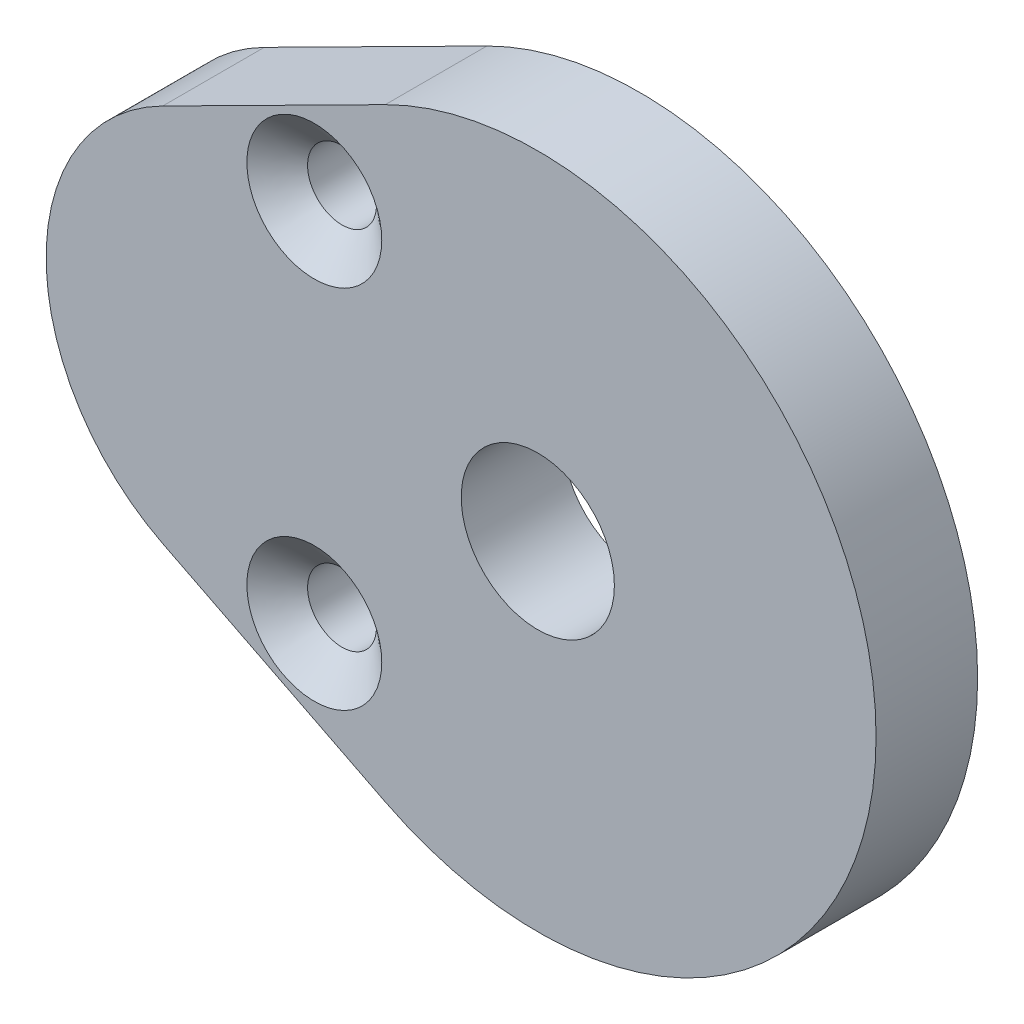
SolidWorks part; units mm, degrees
ref_plane "Front Plane" through (0, 0, 0) normal (0, 0, 1) x (1, 0, 0)
ref_plane "Top Plane" through (0, 0, 0) normal (0, 1, 0) x (1, 0, 0)
ref_plane "Right Plane" through (0, 0, 0) normal (1, 0, 0) x (0, 0, -1)
sketch "Sketch2" plane through (0, 0, 0) normal (0, 0, 1) x (1, 0, 0)
  line L0 (-20.5835, 6.1779) -> (-6.6714, 13.206) construction
  line L1 (-20.5835, -6.1779) -> (-6.6714, -13.206) construction
  line L2 (-23.4467, -11.8457) -> (-9.5347, -18.8738)
  line L3 (-23.4467, 11.8457) -> (-9.5347, 18.8738)
  arc A0 (-6.6714, -13.206) -> (-6.6714, 13.206) centre (0, 0) ccw construction
  arc A1 (-20.5835, 6.1779) -> (-20.5835, -6.1779) centre (-17.4625, 0) ccw construction
  arc A2 (-23.4467, 11.8457) -> (-23.4467, -11.8457) centre (-17.4625, 0) ccw
  arc A3 (-9.5347, -18.8738) -> (-9.5347, 18.8738) centre (0, 0) ccw
extrude "Boss-Extrude1" add sketch "Sketch2" along normal blind 6.35
sketch "Sketch3" plane through (0, 0, 6.35) normal (0, 0, 1) x (1, 0, 0)
  circle A0 centre (0, 0) radius 4.7879
extrude "Cut-Extrude1" cut sketch "Sketch3" against normal through all
sketch "Sketch6" plane through (0, 0, 6.35) normal (0, 0, 1) x (1, 0, 0)
  point P0 (-13.97, 11.43)
  point P2 (-13.97, -11.43)
  dimension "D1" = 11.43
  dimension "D2" = 13.97
  dimension "D3" = 11.43
  dimension "D4" = 13.97
hole_wizard "CSK for #8 Flat Head Machine Screw (100)1" positions "Sketch6" profile "Sketch5" countersink size "#8" standard "ANSI Inch"
sketch "Sketch5" plane through (-13.97, 11.43, 6.35) normal (1, 0, 0) x (0, -1, 0)
  line L0 (0, 0) -> (0, 6.35)
  line L1 (0, 6.35) -> (2.1526, 6.35)
  line L2 (2.1526, 6.35) -> (2.1526, 1.7317)
  line L3 (2.1526, 1.7317) -> (4.2164, 0)
  line L5 (4.2164, 0) -> (0, 0)
  line L6 (-2.1526, 1.7317) -> (-4.2164, 0) construction
  line L11 (0, -6.35) -> (0, 107.95) construction
  dimension "Thru Hole Dia." = 4.3053
  dimension "Thru Hole Depth" = 6.35
  dimension "Near C'Sink Dia." = 8.4328
  dimension "Near C'Sink Angle" = 100
equation "\"G\"= 1in'Gear - Gear Pitch Diameter"
equation "\"P\"= 3 / 8in'Pinion - Gear Pitch Diameter"
equation "\"MountDist\"= ( \"G\" + \"P\" ) / 2in'Mounting Distance"
equation "\"Ghd\"= 0.63in'Gear - Gear Hub Diameter"
equation "\"Ghw\"= 0.25in'Gear - Gear Hub Width"
equation "\"Gw\"= 0.375in'Gear - Overall Width"
equation "\"Phd\"= 0.28in'Pinion - Gear Hub Diameter"
equation "\"Phw\"= 0.19in'Pinion - Gear Hub Width"
equation "\"Pw\"= .315'Pinion - Overall Width"
equation "\"GD\"= 1.04in'Gear - Outer Diameter"
equation "\"PD\"= 0.42in'Pininon - Outer Diameter"
equation "\"inJB\"= 0.252in'Input Journal Bearing - Outer Diameter"
equation "\"outJB\"= 0.377in'Output Journal Bearing - Outer Diameter"
equation "\"L_JB\"= 0.25in'Journal Bearing Length"
equation "\"Ht\"= 0.25in'Housing Thickness"
equation "\"clear\"= 0.125in'Clearance for moving parts"
equation "\"D1@Sketch2\"=\"GD\" + \"clear\""
equation "\"D2@Sketch2\"=\"PD\" + \"clear\""
equation "\"D3@Sketch2\"=\"MountDist\""
equation "\"D1@Boss-Extrude1\"=\"Ht\""
equation "\"D1@Sketch3\"=\"outJB\""
equation "\"D4@Sketch2\"=\"Ht\""
equation "\"D1@Boss-Extrude2\"=\"L_JB\""
equation "\"D1@Sketch3\"=\"outJB\" + 2* \"Ht\""
equation "\"D2@Sketch3\"=\"inJB\" + 2* \"Ht\""
equation "\"D3@Sketch3\"=\"MountDist\""
equation "\"D1@Boss-Extrude3\"=\"Ghw\" - \"Phw\" + \"clear\""
equation "\"D1@Sketch5\"=\"Ghd\" + 2* \"Ht\""
equation "\"D2@Sketch5\"=\"Phd\" + 2* \"Ht\""
equation "\"D1@Sketch7\"=\"GD\" + \"clear\""
equation "\"D2@Sketch7\"=\"PD\"+ \"clear\""
equation "\"D3@Sketch7\"=\"Ht\""
equation "\"D1@Boss-Extrude4\"=\"Gw\"-\"Ghw\" + \"clear\" *3/2"
equation "\"D2@Sketch8\"=\"inJB\""
equation "\"D1@Sketch9\"=\"GD\"+.125"
equation "\"D2@Sketch9\"=\"PD\"+.125"
equation "\"D1@Cut-Extrude2\"=\"Gw\"-\"Ghw\"+ \"clear\"/2"
equation "\"D1@Sketch10\"=\"Ghd\"+.125"
equation "\"D1@Cut-Extrude3\"=\"Ghw\""
equation "\"D1@Sketch11\"=\"Phd\"+.125"
